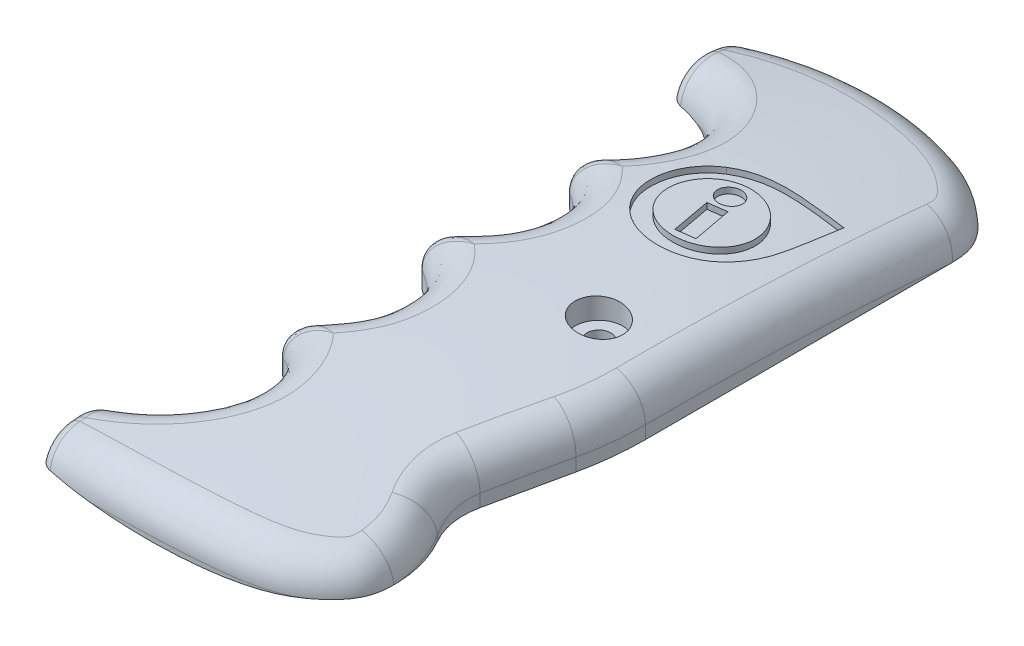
SolidWorks part; units mm, degrees
other "<parte02>-<Cortar-Extruir5>"
ref_plane "Alzado" through (0, 0, 0) normal (0, 0, 1) x (1, 0, 0)
ref_plane "Planta" through (0, 0, 0) normal (0, 1, 0) x (1, 0, 0)
ref_plane "Vista lateral" through (0, 0, 0) normal (1, 0, 0) x (0, 0, -1)
mirrored part "parte02_Simétrica"
